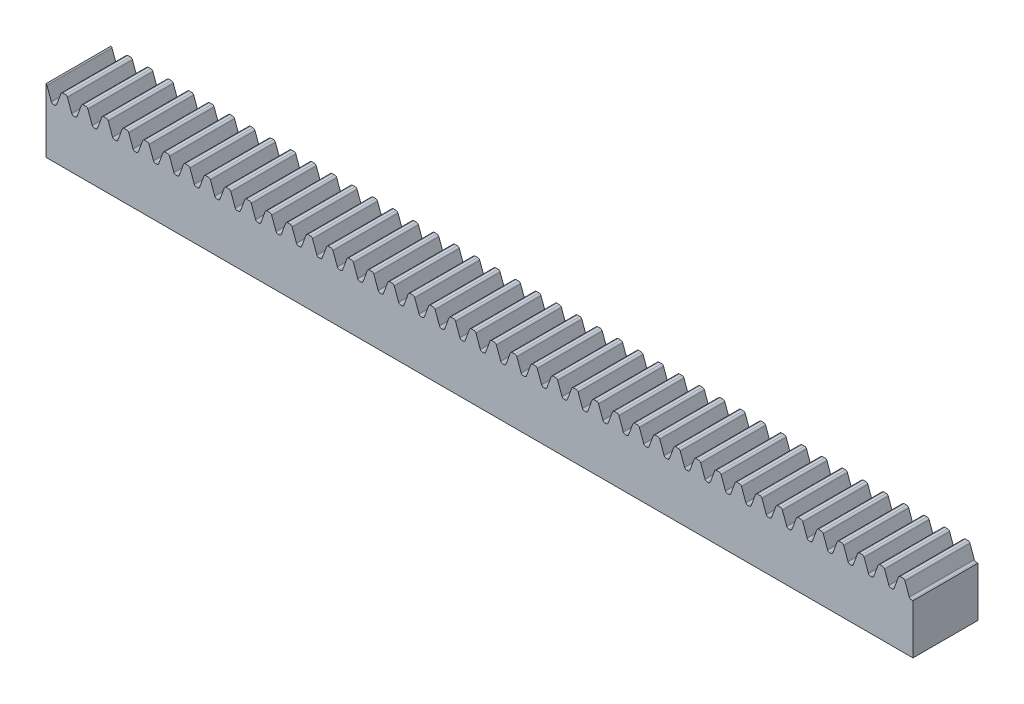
SolidWorks part; units mm, degrees
ref_plane "Front Plane" through (0, 0, 0) normal (0, 0, 1) x (1, 0, 0)
ref_plane "Top Plane" through (0, 0, 0) normal (0, 1, 0) x (1, 0, 0)
ref_plane "Right Plane" through (0, 0, 0) normal (1, 0, 0) x (0, 0, -1)
sketch "Sketch1" plane through (0, 0, 0) normal (0, 0, 1) x (1, 0, 0)
  line L0 (-250, 7.4) -> (-250, -7.4) construction
  line L1 (-250, -7.4) -> (250, -7.4) construction
  line L2 (250, -7.4) -> (250, 7.4) construction
  line L4 (0, 7.4) -> (0, -7.4) construction
  line L5 (-250, 5.9) -> (250, 5.9) construction
  line L6 (-248.0326, 7.4) -> (-246.7683, 7.4) construction
  line L7 (-246.7683, 7.4) -> (-245.5399, 4.025) construction
  line L8 (-248.0326, 7.4) -> (-249.261, 4.025) construction
  line L9 (-249.261, 4.025) -> (-245.5399, 4.025) construction
  line L10 (-247.4004, 7.4) -> (-247.4004, 4.025) construction
  line L11 (-250, 0) -> (-237.9756, 0) construction
  line L12 (250, 0) -> (237.9756, 0) construction
  point P15 (-242.688, 7.4)
  point P16 (-53, -7.4)
  point P17 (-246.2223, 5.9)
  point P18 (-248.5785, 5.9)
  point P21 (-0.75, -7.4)
sketch "Sketch2" plane through (0, 0, 0) normal (1, 0, 0) x (0, 0, -1)
  line L0 (-7.5, 0) -> (7.5, 0) construction
  dimension "Face Width" = 15
sketch "Sketch3" plane through (0, 0, 0) normal (0, 0, 1) x (1, 0, 0)
  line L1 (-250, 7.4) -> (250, 7.4)
  line L2 (-250, 7.4) -> (-250, -7.4)
  line L3 (-250, -7.4) -> (250, -7.4)
  line L4 (250, 7.4) -> (250, -7.4)
extrude "Boss-Extrude1" add sketch "Sketch3" against normal up to vertex (7.5 mm away) and the other way up to vertex (7.5 mm away)
sketch "Sketch4" plane through (0, 0, 0) normal (0, 0, 1) x (1, 0, 0)
  line L0 (-247.4004, 7.4) -> (-242.688, 7.4) construction
  line L9 (-245.0442, 7.4) -> (-245.0442, 4.025)
  line L10 (-245.0442, 4.025) -> (-245.5399, 4.025)
  line L11 (-245.5399, 4.025) -> (-246.7683, 7.4)
  line L12 (-246.7683, 7.4) -> (-245.0442, 7.4)
  line L13 (-248.0326, 7.4) -> (-249.261, 4.025)
  line L14 (-249.261, 4.025) -> (-249.7566, 4.025)
  line L15 (-249.7566, 4.025) -> (-249.7566, 7.4)
  line L16 (-249.7566, 7.4) -> (-248.0326, 7.4)
  line L17 (250, 7.4) -> (-250, 7.4) construction
  line L18 (-248.0326, 7.4) -> (-247.6802, 7.4)
  line L19 (-247.1207, 7.4) -> (-246.7683, 7.4)
  arc A0 (-249.6133, 4.025) -> (-249.1404, 4.3561) centre (-249.6133, 4.5283) ccw
  arc A1 (-245.6604, 4.3561) -> (-245.1875, 4.025) centre (-245.1875, 4.5283) ccw
  arc A2 (-248.1531, 7.0689) -> (-247.6802, 7.4) centre (-247.6802, 6.8967) cw
  arc A3 (-247.1207, 7.4) -> (-246.6478, 7.0689) centre (-247.1207, 6.8967) cw
extrude "Cut-Extrude1" cut sketch "Sketch4" against normal through all both and the other way through all contours L14 A0 L13 L16 L15 | L13 A2 L18 | L19 A3 L11 | L11 A1 L10 L9 L12
pattern_linear "LPattern1" count 107 spacing 4.7124 along (1, 0, 0) count 2 spacing 4.7124 along (-1, 0, 0) of "Cut-Extrude1"
sketch "Drawing Refernce 1" plane through (0, 0, 7.5) normal (0, 0, 1) x (1, 0, 0)
  line L0 (-250, 0) -> (250, 0) construction
  point P6 (-235, 0)
  point P7 (-227.5, 0)
  point P8 (235, 0)
sketch "Sketch5" plane through (0, 0, 7.5) normal (0, 0, 1) x (1, 0, 0)
  line L0 (-250, -7.4) -> (-250, 10.7263)
  line L2 (-250, 10.7263) -> (-150, 10.7263)
  line L3 (-150, 10.7263) -> (-150, -7.4)
  line L4 (-250, -7.4) -> (-150, -7.4)
  point P5 (250, 7.4)
  dimension "D1" = 100
extrude "Cut-Extrude2" cut sketch "Sketch5" against normal blind 2500
sketch "Sketch6" plane through (0, 0, 7.5) normal (0, 0, 1) x (1, 0, 0)
  line L0 (-150, -7.4) -> (-150, 14.2227)
  line L1 (-150, 14.2227) -> (50, 14.2227)
  line L2 (50, 14.2227) -> (50, -13.307)
  line L3 (50, -13.307) -> (-150, -13.307)
  line L4 (-150, -13.307) -> (-150, -7.4)
  dimension "D1" = 200
extrude "Cut-Extrude3" cut sketch "Sketch6" against normal blind 30
sketch "Sketch7" plane through (50, 0, 0) normal (-1, 0, 0) x (0, 0, 1)
  line L10 (-7.5, -7.4) -> (7.5, -7.4) construction
  line L18 (-3.65, -4.9) -> (3.65, -4.9)
  line L19 (3.65, -4.9) -> (3.65, 1.94)
  line L20 (3.65, 1.94) -> (-3.65, 1.94)
  line L21 (-3.65, 1.94) -> (-3.65, -4.9)
  dimension "D1" = 2.5
  dimension "D2" = 7.3
  dimension "D3" = 3.65
  dimension "D4" = 6.84
extrude "Cut-Extrude4" cut sketch "Sketch7" against normal blind 21
equation "\"Diametral Pitch\"= 1 / \"Module\""
equation "\"Pressure Angle\"=20"
equation "\"Dedendum\"= 1.25 / \"Diametral Pitch\""
equation "\"Addendum\"= 1 / \"Diametral Pitch\""
equation "\"WorkingDepth\"= 2 / \"Diametral Pitch\""
equation "\"WholeDepth\"= 2.25 / \"Diametral Pitch\""
equation "\"Clearance\"= 0.25 / \"Diametral Pitch\""
equation "\"ToothThickness\"= ( pi / 2 ) / \"Diametral Pitch\""
equation "\"CircularPitch\"= pi / \"Diametral Pitch\""
equation "\"Fillet\"= \"Clearance\" * cos ( \"Pressure Angle\" ) * tan ( ( 90 + \"Pressure Angle\" ) / 2 )"
equation "\"Module\"= 1.5"
equation "\"Addendum@Sketch1\"=\"Addendum\""
equation "\"Pressure Angle@Sketch1\"=\"Pressure Angle\""
equation "\"Dedendum@Sketch1\"=\"Dedendum\""
equation "\"Circular Pitch@Sketch1\"=\"CircularPitch\""
equation "\"Circular Tooth Thickness@Sketch1\"=\"ToothThickness\""
equation "\"Module@Sketch1\"=\"Module\""
equation "\"Approximate Number of Teeth@Sketch1\" = int ( \"Length@Sketch1\" /  ( 2 * \"Circular Tooth Thickness@Sketch1\" )  ) "
equation "\"Rack Length@Sketch1\" = \"Circular Pitch@Sketch1\" *  ( \"Approximate Number of Teeth@Sketch1\" - 1 ) "
equation "\"D3@LPattern1\"=\"CircularPitch\""
equation "\"D1@LPattern1\"=\"Approximate Number of Teeth@Sketch1\"+1"
equation "\"D1@Sketch1\"=\"Circular Pitch@Sketch1\"*2"
equation "\"D1@Sketch4\"=\"Fillet\""
equation "\"D4@LPattern1\"=\"CircularPitch\""
equation "\"D2@Drawing Refernce 1\"=\"D1@Drawing Refernce 1\"*1.5"
equation "\"D3@Drawing Refernce 1\"=\"D1@Drawing Refernce 1\""
